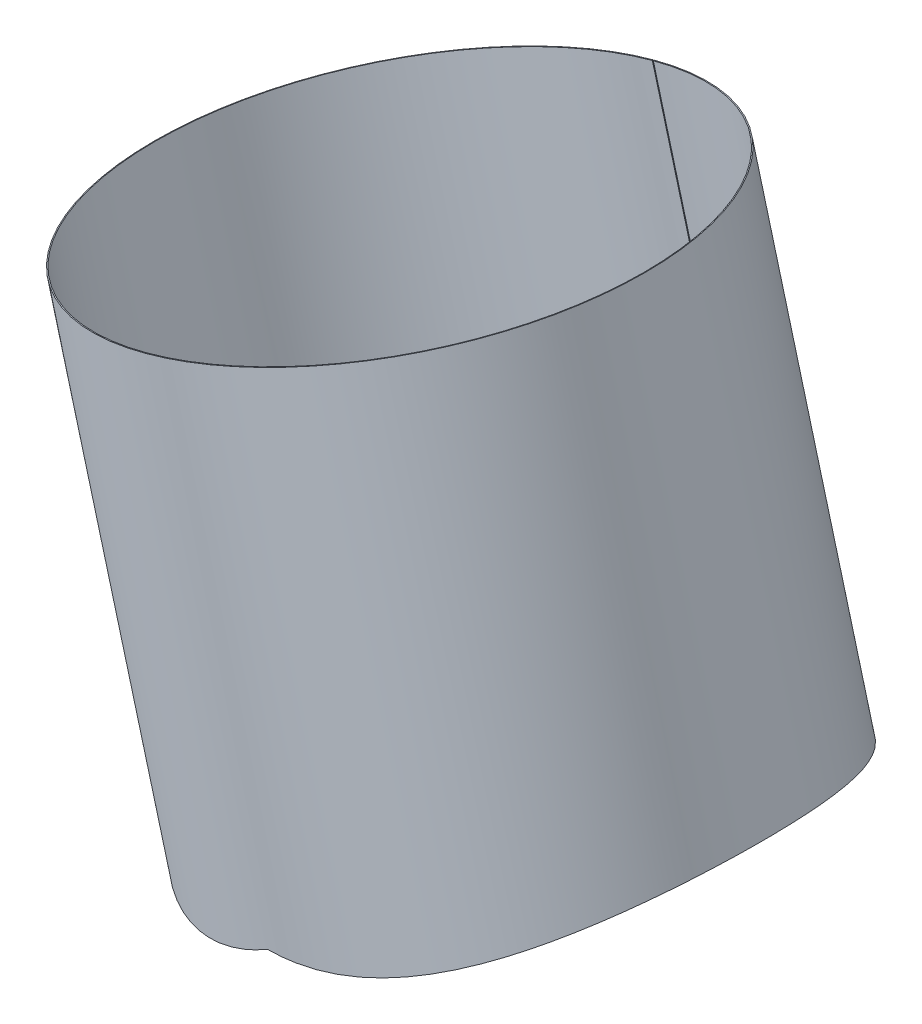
SolidWorks part; units mm, degrees
ref_plane "前视基准面" through (0, 0, 0) normal (0, 0, 1) x (1, 0, 0)
ref_plane "上视基准面" through (0, 0, 0) normal (0, 1, 0) x (1, 0, 0)
ref_plane "右视基准面" through (0, 0, 0) normal (1, 0, 0) x (0, 0, -1)
imported_body "基体零件-弯头节对接缝上平接分支管管-1"
sheet metal parameters "钣金1" parameters "D1"=0.7366, "厚度"=1
bend "圆角折弯1" bend radius 249 bend angle 359.771 parameters "D5"=1
flatten bends "展开-折弯1"
sketch "尖角-草图1" plane through (-375.2867, 1398.6572, -249.9995) normal (-0.0019, -0.0005, -1) x (-1, 0, 0.0019)
  line L0 (815.1291, 21.6197) -> (695.1123, -426.2884) construction
  dimension "D1" = 0
process bends "加工-折弯1" parameters "D1"=0
sketch "平面-草图1" plane through (-375.2867, 1398.6572, -249.9995) normal (-0.0019, -0.0005, -1) x (-1, 0, 0.0019)
